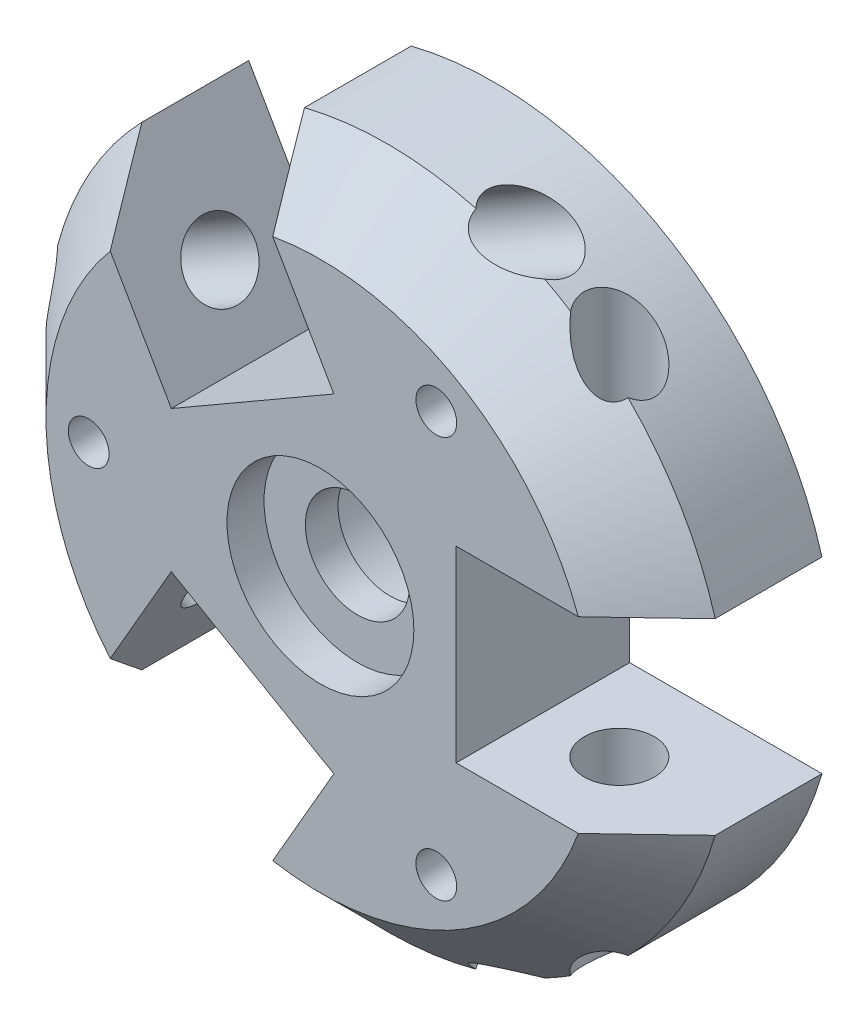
SolidWorks part; units mm, degrees
ref_plane "Front Plane" through (0, 0, 0) normal (0, 0, 1) x (1, 0, 0)
ref_plane "Top Plane" through (0, 0, 0) normal (0, 1, 0) x (1, 0, 0)
ref_plane "Right Plane" through (0, 0, 0) normal (1, 0, 0) x (0, 0, -1)
sketch "Sketch1" plane through (0, 0, 0) normal (0, 0, 1) x (1, 0, 0)
  circle A0 centre (0, 0) radius 11.684
  dimension "D1" = 23.368
extrude "Extrude1" add sketch "Sketch1" against normal blind 5.9436
sketch "Sketch2" plane through (0, 0, 0) normal (0, 0, 1) x (1, 0, 0)
  line L0 (0, 0) -> (21.6349, 0) construction
  line L2 (4.6482, 3.2131) -> (18.3123, 3.2131)
  line L3 (4.6482, 3.2131) -> (4.6482, -3.2131)
  line L4 (4.6482, -3.2131) -> (18.3123, -3.2131)
  line L5 (18.3123, 3.2131) -> (18.3123, -3.2131)
  dimension "D1" = 6.4262
  dimension "D2" = 13.6641
  dimension "D3" = 3.2131
  dimension "D4" = 6.4262
  dimension "D5" = 4.6482
extrude "Cut-Extrude1" cut sketch "Sketch2" against normal through all
pattern_circular "CirPattern1" count 3 over 360 about axis through (0, 0, 0) along (0, 0, 1) of "Cut-Extrude1"
ref_plane "Plane1" through (0, 16.764, 0) normal (0, 1, 0) x (-1, 0, 0)
sketch "Sketch9" plane through (0, 16.764, 0) normal (0, 1, 0) x (-1, 0, 0)
  line L0 (0, 0) -> (0, -8.1044) construction
  line L1 (0, -5.9436) -> (0, 0) construction
  line L2 (2.8341, 0) -> (-11.2335, 0) construction
  circle A0 centre (-7.2644, -2.9718) radius 1.2001
  dimension "D2" = 2.4003
  dimension "D1" = 7.2644
  dimension "D3" = 2.9718
extrude "Cut-Extrude2" cut sketch "Sketch9" against normal through all
pattern_circular "CirPattern2" count 3 over 360 about axis through (0, 0, -5.9436) along (0, 0, 1) of "Cut-Extrude2"
hole_wizard "#54 (0.055) Diameter Hole1" positions "Sketch14" profile "Sketch13" hole size "#54" standard "Ansi Inch"
sketch "Sketch14" plane through (0, 0, 0) normal (0, 0, 1) x (1, 0, 0)
  line L0 (0, 0) -> (-13.0166, 0) construction
  point P0 (-7.9375, 0)
  dimension "D1" = 7.9375
sketch "Sketch13" plane through (-7.9375, 0, 0) normal (1, 0, 0) x (0, -1, 0)
  line L0 (0, 0) -> (0, 5.1822)
  line L1 (0, 5.1822) -> (0.6985, 4.7625)
  line L2 (0.6985, 4.7625) -> (0.6985, 0)
  line L5 (0.6985, 0) -> (0, 0)
  line L10 (0, 5.1822) -> (-0.6985, 4.7625) construction
  line L11 (0, -6.35) -> (0, 107.95) construction
  dimension "Hole Dia." = 1.397
  dimension "Hole Depth" = 4.7625
  dimension "Drill Angle" = 118
sketch "Sketch15" plane through (0, 0, 0) normal (0, 0, 1) x (1, 0, 0)
  line L0 (0, 0) -> (-19.3932, 0) construction
pattern_circular "CirPattern3" count 3 over 360 about axis through (0, 0, 0) along (0, 0, 1) of "#54 (0.055) Diameter Hole1"
sketch "Sketch16" plane through (0, 0, 0) normal (0, 0, 1) x (1, 0, 0)
  circle A0 centre (0, 0) radius 1.7859
  dimension "D1" = 3.5719
extrude "Cut-Extrude3" cut sketch "Sketch16" against normal through all
sketch "Sketch17" plane through (0, 0, 0) normal (0, 0, 1) x (1, 0, 0)
  circle A0 centre (0, 0) radius 3.2004
  dimension "D1" = 6.4008
extrude "Cut-Extrude4" cut sketch "Sketch17" against normal blind 1.27
ref_plane "Plane2" through (0, 0, -5.9436) normal (0, 0, -1) x (-1, 0, 0)
ref_plane "Plane3" through (0, 0, -5.9436) normal (0, 0, -1) x (-1, 0, 0)
sketch "Sketch18" plane through (0, 0, -5.9436) normal (0, 0, -1) x (-1, 0, 0)
  circle A0 centre (0, 0) radius 2.9718
  dimension "D1" = 5.9436
extrude "Cut-Extrude5" cut sketch "Sketch18" against normal blind 3.556
chamfer "Chamfer1" distance 2.286 angle 45 1 edges at (5.842, 10.1186, 0)
chamfer "Chamfer2" distance 2.286 angle 45 1 edges at (5.842, -10.1186, 0)
chamfer "Chamfer3" distance 2.286 angle 45 1 edges at (-11.684, 0, 0)
